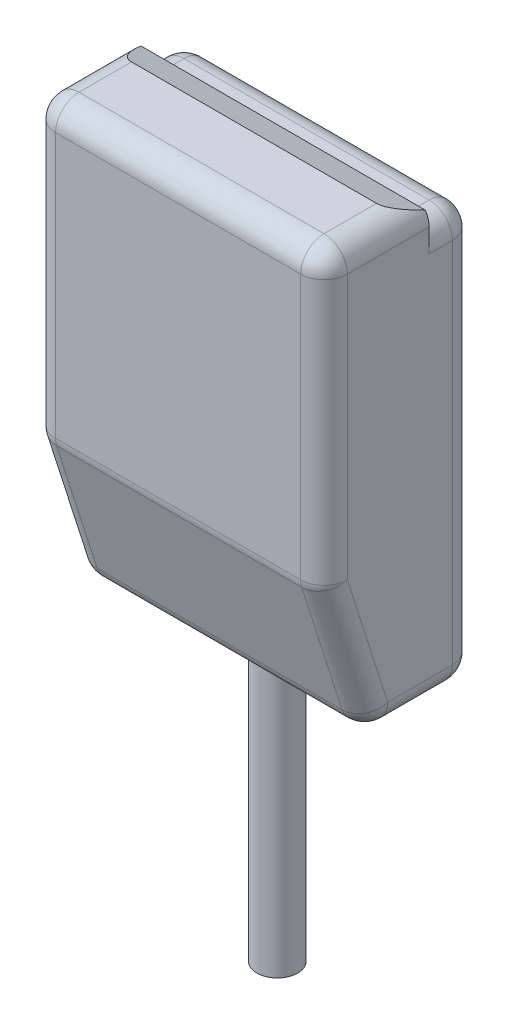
SolidWorks part; units mm, degrees
ref_plane "Plan de face" through (0, 0, 0) normal (0, 0, 1) x (1, 0, 0)
ref_plane "Plan de dessus" through (0, 0, 0) normal (0, 1, 0) x (1, 0, 0)
ref_plane "Plan de droite" through (0, 0, 0) normal (1, 0, 0) x (0, 0, -1)
sketch "Esquisse1" plane through (0, 0, 0) normal (1, 0, 0) x (0, 0, -1)
  line L0 (-4, 0) -> (-15.0802, 0)
  line L1 (0, 4) -> (0, 67)
  line L2 (-18.8899, 2.7809) -> (-25.8097, 24.4053)
  line L3 (-26, 25.6244) -> (-26, 71)
  line L4 (-22, 75) -> (-13, 75)
  line L5 (-8, 73.1801) -> (-8, 71)
  line L6 (-8, 71) -> (-4, 71)
  line L7 (-13, 75) -> (-8, 73.1801)
  arc A0 (-22, 75) -> (-26, 71) centre (-22, 71) ccw
  arc A1 (-26, 25.6244) -> (-25.8097, 24.4053) centre (-22, 25.6244) ccw
  arc A2 (-15.0802, 0) -> (-18.8899, 2.7809) centre (-15.0802, 4) cw
  arc A3 (0, 4) -> (-4, 0) centre (-4, 4) cw
  arc A4 (-4, 71) -> (0, 67) centre (-4, 67) cw
  point P11 (-26, 75)
  point P14 (-26, 25)
  point P17 (-18, 0)
  point P20 (0, 0)
  dimension "D6" = 4
  dimension "D1" = 26
  dimension "D2" = 50
  dimension "D3" = 75
  dimension "D4" = 18
  dimension "D5" = 4
  dimension "D7" = 20
  dimension "D8" = 5
extrude "Extrusion1" add sketch "Esquisse1" along normal blind 50
sketch "Esquisse2" plane through (0, 0, 0) normal (0, -1, 0) x (1, 0, 0)
  line L0 (0, 15.0802) -> (0, 4) construction
  line L1 (50, 0) -> (0, 0) construction
  circle A0 centre (25, 9) radius 3.5
  dimension "D1" = 25
  dimension "D2" = 7
  dimension "D3" = 9
extrude "Extrusion2" add sketch "Esquisse2" along normal blind 50
fillet "Congé1" radius 4 11 edges at (50, 71, 6) (50, 69.8284, 1.1716) (50, 35.5, 0) (50, 1.1716, 1.1716) (50, 0, 9.5401) (50, 0.7692, 17.4385) (50, 13.5931, 22.3498) (50, 25.0075, 25.9521) (50, 48.3122, 26) (50, 73.8284, 24.8284) (50, 75, 17.5)
fillet "Congé2" radius 4 11 edges at (0, 75, 17.5) (0, 73.8284, 24.8284) (0, 71, 6) (0, 69.8284, 1.1716) (0, 35.5, 0) (0, 1.1716, 1.1716) (0, 0, 9.5401) (0, 0.7692, 17.4385) (0, 13.5931, 22.3498) (0, 25.0075, 25.9521) (0, 48.3122, 26)
